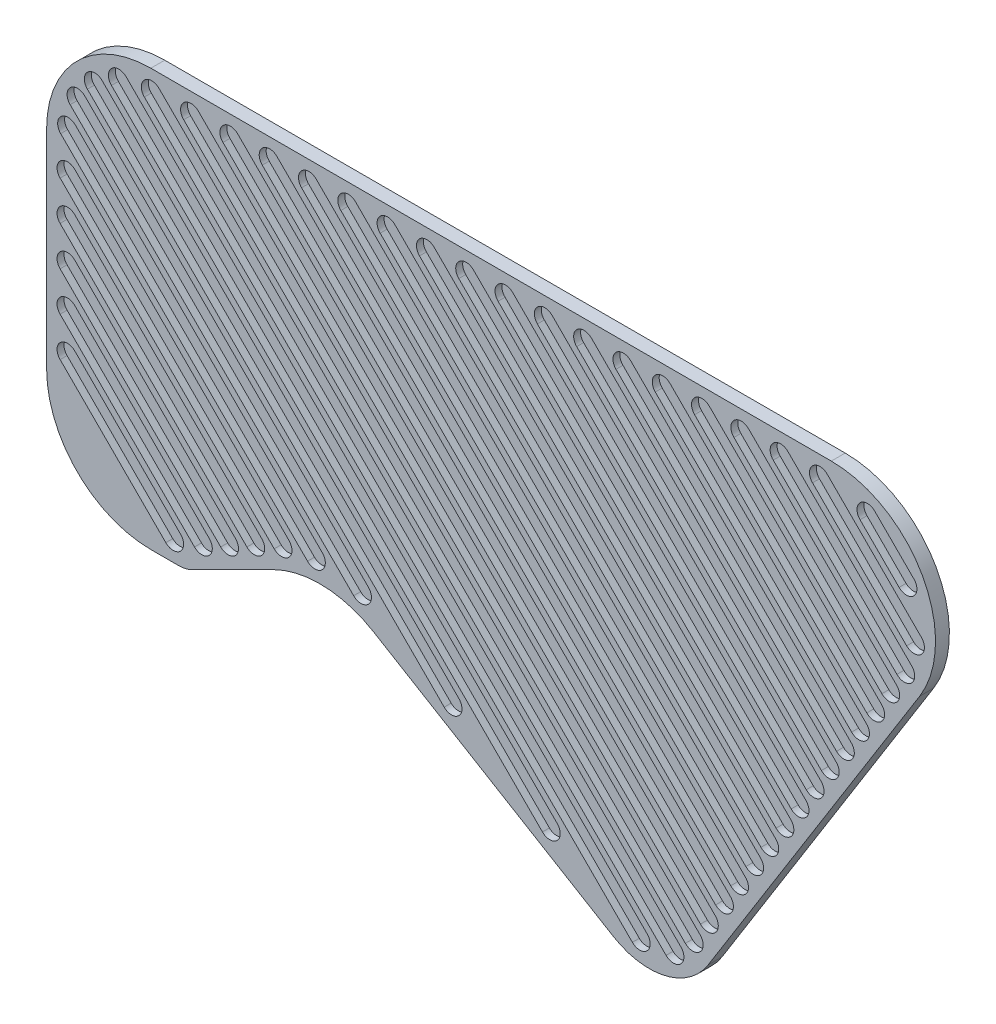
SolidWorks part; units mm, degrees
ref_plane "Ebene vorne" through (0, 0, 0) normal (0, 0, 1) x (1, 0, 0)
ref_plane "Ebene oben" through (0, 0, 0) normal (0, 1, 0) x (1, 0, 0)
ref_plane "Ebene rechts" through (0, 0, 0) normal (1, 0, 0) x (0, 0, -1)
sketch "Skizze1" plane through (0, 0, 0) normal (0, 0, 1) x (1, 0, 0)
  line L0 (0, 75) -> (0, 225)
  line L1 (75, 300) -> (564.6814, 300)
  line L2 (628.2813, 185.2501) -> (476.0225, -58.364)
  line L3 (407.8978, -74.7387) -> (235.3038, 28.8177)
  line L4 (163.1756, 31.5878) -> (104.2229, 2.1115)
  line L5 (95.2786, 0) -> (75, 0)
  arc A0 (0, 225) -> (75, 300) centre (75, 225) cw
  arc A1 (0, 75) -> (75, 0) centre (75, 75) ccw
  arc A2 (564.6814, 300) -> (628.2813, 185.2501) centre (564.6814, 225) cw
  arc A3 (235.3038, 28.8177) -> (163.1756, 31.5878) centre (196.7166, -35.4942) ccw
  arc A4 (104.2229, 2.1115) -> (95.2786, 0) centre (95.2786, 20) cw
  arc A5 (476.0225, -58.364) -> (407.8978, -74.7387) centre (433.6226, -31.864) cw
  point P9 (0, 300)
  point P12 (0, 0)
  point P15 (700, 300)
  point P18 (200, 50)
  point P21 (100, 0)
  point P24 (450, -100)
  dimension "D1" = 300
  dimension "D8" = 75
  dimension "D9" = 20
  dimension "D10" = 50
  dimension "D2" = 700
  dimension "D3" = 400
  dimension "D4" = 50
  dimension "D5" = 200
  dimension "D6" = 100
  dimension "D7" = 450
extrude "Linear austragen1" add sketch "Skizze1" along normal blind 10
sketch "Skizze2" plane through (0, 0, 10) normal (0, 0, 1) x (1, 0, 0)
  line L0 (15, 91.066) -> (91.066, 15) construction
  line L1 (20.3033, 96.3693) -> (96.3693, 20.3033)
  line L2 (9.6967, 85.7627) -> (85.7627, 9.6967)
  line L3 (0, 0) -> (31.156, 0) construction
  line L17 (15, 225) -> (15, 75)
  line L18 (75, 15) -> (95.2786, 15)
  line L19 (97.5147, 15.5279) -> (156.4674, 45.0042)
  line L20 (243.0212, 41.6801) -> (415.6152, -61.8763)
  line L21 (463.3025, -50.414) -> (615.5613, 193.2001)
  line L22 (564.6814, 285) -> (75, 285)
  line L23 (15, 225) -> (15, 75) construction
  line L24 (75, 15) -> (95.2786, 15) construction
  line L25 (97.5147, 15.5279) -> (156.4674, 45.0042) construction
  line L26 (243.0212, 41.6801) -> (415.6152, -61.8763) construction
  line L27 (463.3025, -50.414) -> (615.5613, 193.2001) construction
  line L28 (564.6814, 285) -> (75, 285) construction
  arc A0 (20.3033, 96.3693) -> (9.6967, 85.7627) centre (15, 91.066) ccw
  arc A1 (85.7627, 9.6967) -> (96.3693, 20.3033) centre (91.066, 15) ccw
  arc A12 (95.2786, 15) -> (97.5147, 15.5279) centre (95.2786, 20) ccw
  arc A13 (95.2786, 15) -> (97.5147, 15.5279) centre (95.2786, 20) ccw construction
  arc A14 (75, 285) -> (15, 225) centre (75, 225) ccw
  arc A15 (15, 75) -> (75, 15) centre (75, 75) ccw
  arc A16 (243.0212, 41.6801) -> (156.4674, 45.0042) centre (196.7166, -35.4942) ccw
  arc A17 (415.6152, -61.8763) -> (463.3025, -50.414) centre (433.6226, -31.864) ccw
  arc A18 (615.5613, 193.2001) -> (564.6814, 285) centre (564.6814, 225) ccw
  arc A19 (75, 285) -> (15, 225) centre (75, 225) ccw construction
  arc A20 (15, 75) -> (75, 15) centre (75, 75) ccw construction
  arc A21 (243.0212, 41.6801) -> (156.4674, 45.0042) centre (196.7166, -35.4942) ccw construction
  arc A22 (415.6152, -61.8763) -> (463.3025, -50.414) centre (433.6226, -31.864) ccw construction
  arc A23 (615.5613, 193.2001) -> (564.6814, 285) centre (564.6814, 225) ccw construction
  point P2 (53.033, 53.033)
  dimension "D1" = 15
  dimension "D2" = 15
  dimension "D3" = 45
  dimension "D4" = 75
extrude "Linear austragen2" cut sketch "Skizze2" against normal blind 5 contours L1 A1 L2 A0
pattern_linear "Lineares Muster3" count 28 spacing 20 of "Linear austragen2"
